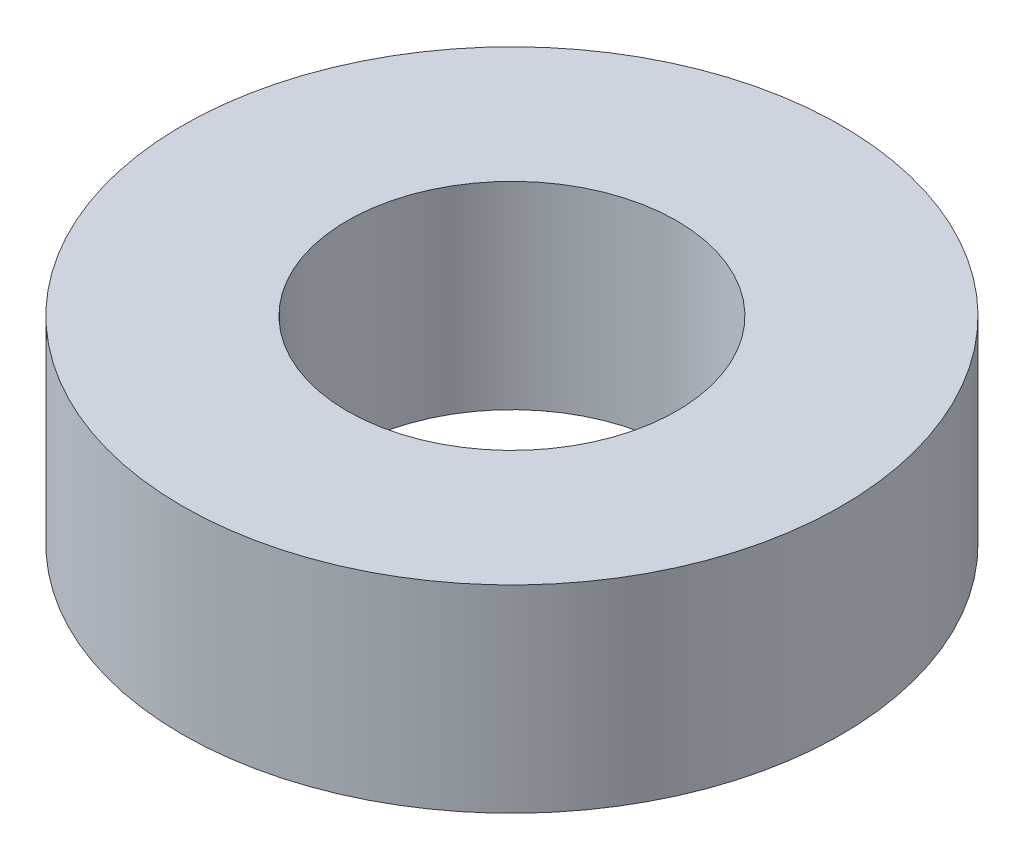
SolidWorks part; units mm, degrees
ref_plane "Front Plane" through (0, 0, 0) normal (0, 0, 1) x (1, 0, 0)
ref_plane "Top Plane" through (0, 0, 0) normal (0, 1, 0) x (1, 0, 0)
ref_plane "Right Plane" through (0, 0, 0) normal (1, 0, 0) x (0, 0, -1)
sketch "Sketch1" plane through (0, 0, 0) normal (0, 1, 0) x (1, 0, 0)
  circle A0 centre (0, 0) radius 50
  circle A1 centre (0, 0) radius 25
  dimension "D1" = 100
  dimension "D2" = 50
extrude "Boss-Extrude1" add sketch "Sketch1" along normal blind 30
